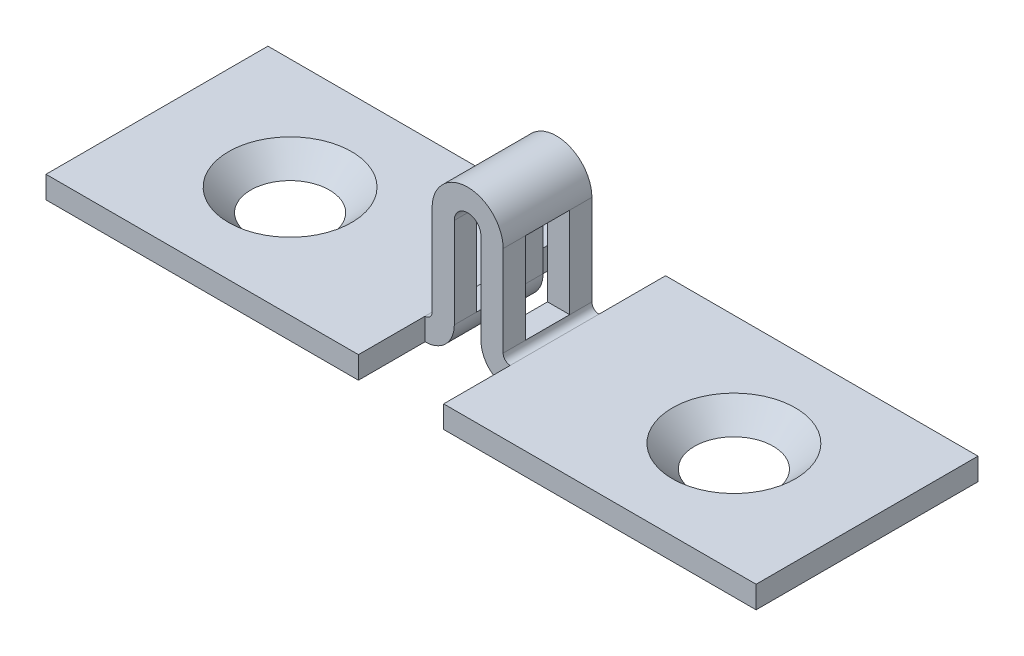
SolidWorks part; units mm, degrees
ref_plane "Front Plane" through (0, 0, 0) normal (0, 0, 1) x (1, 0, 0)
ref_plane "Top Plane" through (0, 0, 0) normal (0, 1, 0) x (1, 0, 0)
ref_plane "Right Plane" through (0, 0, 0) normal (1, 0, 0) x (0, 0, -1)
sketch "Sketch1" plane through (0, 0, 0) normal (0, 0, 1) x (1, 0, 0)
  line L0 (12.7, 0) -> (1.524, 0)
  line L1 (1.27, 0.254) -> (1.27, 3.4925)
  line L2 (0, 0) -> (0, 3.4925) construction
  line L3 (-12.7, 0) -> (-1.524, 0)
  line L4 (-1.27, 0.254) -> (-1.27, 3.4925)
  arc A0 (1.524, 0) -> (1.27, 0.254) centre (1.524, 0.254) cw
  arc A1 (-1.524, 0) -> (-1.27, 0.254) centre (-1.524, 0.254) ccw
  arc A2 (-1.27, 3.4925) -> (1.27, 3.4925) centre (0, 3.4925) cw
  dimension "D3" = 0.254
  dimension "D1" = 25.4
  dimension "D2" = 2.54
  dimension "D4" = 4.7625
extrude "Extrude-Thin1" add sketch "Sketch1" along normal mid plane 7.9375 thin
sketch "Sketch2" plane through (0, -0.7937, 0) normal (0, -1, 0) x (1, 0, 0)
  line L0 (1.524, 3.9688) -> (1.524, -3.9688) construction
  line L1 (-1.524, 3.9688) -> (1.524, 3.9688)
  line L2 (-1.524, 3.9688) -> (-1.524, 1.5875)
  line L3 (-1.524, 1.5875) -> (1.524, 1.5875)
  line L4 (1.524, 3.9688) -> (1.524, 1.5875)
  line L6 (-1.524, -3.9688) -> (1.524, -3.9688)
  line L7 (-1.524, -3.9688) -> (-1.524, -1.5875)
  line L8 (-1.524, -1.5875) -> (1.524, -1.5875)
  line L9 (1.524, -3.9688) -> (1.524, -1.5875)
  dimension "D1" = 3.175
extrude "Extrude1" cut sketch "Sketch2" against normal through all
hole_wizard "CSK for M2 Flat Head Machine Screw1" positions "Sketch4" profile "Sketch3" countersink size "M2" standard "Ansi Metric"
sketch "Sketch4" plane through (0, 0, 0) normal (0, 1, 0) x (-1, 0, 0)
  line L0 (0, 0) -> (0, 7.4907) construction
  point P0 (-7.9375, 0)
  point P1 (7.9375, 0)
  dimension "D1" = 15.875
sketch "Sketch3" plane through (7.9375, 0, 0) normal (1, 0, 0) x (0, 0, 1)
  line L0 (0, 0) -> (0, 0.7938)
  line L1 (0, 0.7938) -> (1.2, 0.7938)
  line L2 (1.2, 0.7938) -> (1.2, 1)
  line L3 (1.2, 1) -> (2.2, 0)
  line L5 (2.2, 0) -> (0, 0)
  line L6 (-1.2, 1) -> (-2.2, 0) construction
  line L11 (0, -6.35) -> (0, 107.95) construction
  dimension "Thru Hole Dia." = 2.4
  dimension "Thru Hole Depth" = 0.7938
  dimension "Near C'Sink Dia." = 4.4
  dimension "Near C'Sink Angle" = 90
sketch "Sketch5" plane through (0, 0, 0) normal (1, 0, 0) x (0, 0, -1)
  line L0 (-1.5875, 3.4925) -> (1.5875, 3.4925) construction
  line L1 (0.7937, 3.4925) -> (-0.7937, 3.4925)
  line L2 (0.7937, 3.4925) -> (0.7937, 0.254)
  line L3 (0.7937, 0.254) -> (-0.7937, 0.254)
  line L4 (-0.7937, 3.4925) -> (-0.7937, 0.254)
  line L5 (-1.5875, 0.254) -> (1.5875, 0.254) construction
  line L6 (0, 0) -> (0, 3.4925) construction
  dimension "D1" = 1.5875
extrude "Extrude2" cut sketch "Sketch5" against normal through all and the other way through all
